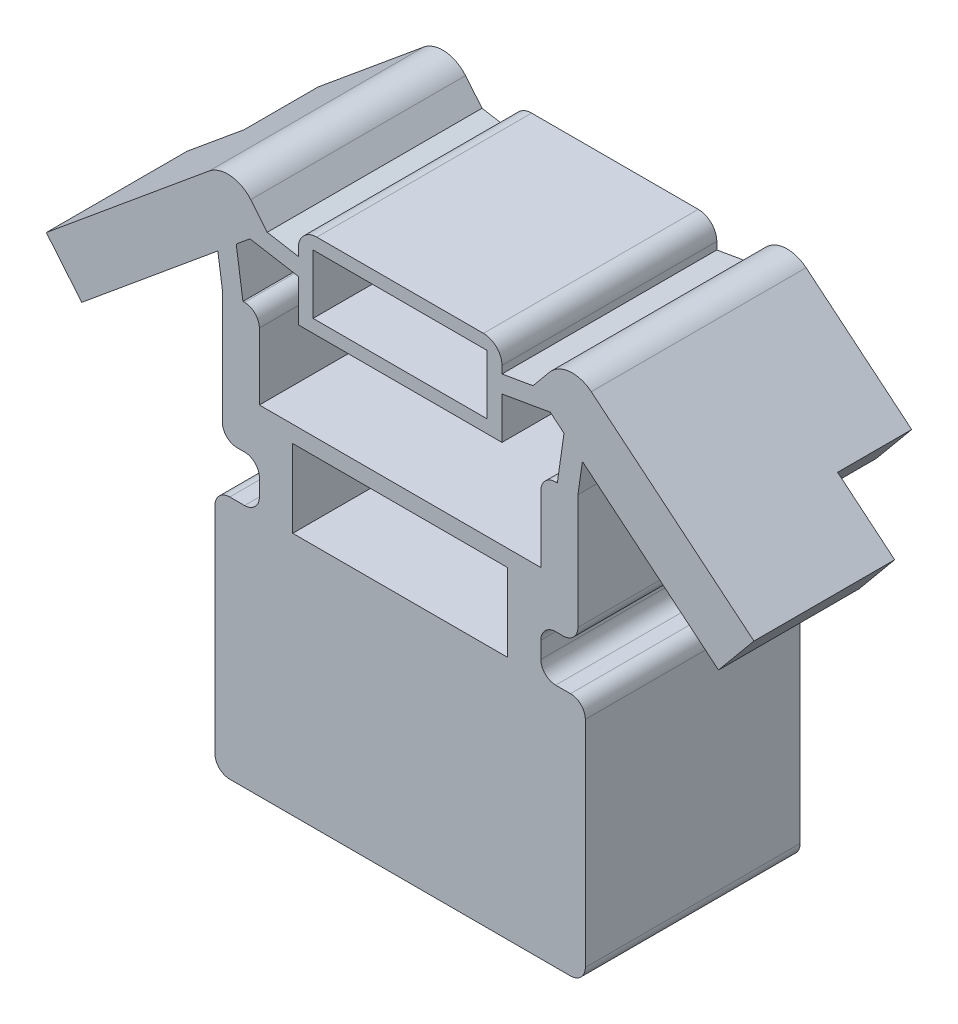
SolidWorks part; units mm, degrees
ref_plane "前视基准面" through (0, 0, 0) normal (0, 0, 1) x (1, 0, 0)
ref_plane "上视基准面" through (0, 0, 0) normal (0, 1, 0) x (1, 0, 0)
ref_plane "右视基准面" through (0, 0, 0) normal (1, 0, 0) x (0, 0, -1)
other "Configuration Table"
sketch "草图1" plane through (0, 0, 0) normal (0, 0, 1) x (1, 0, 0)
  line L0 (2.75, 5.4) -> (3.5876, 5.5447)
  line L1 (-3.8, -1.4) -> (3.8, -1.4)
  line L2 (-3.8, -1.4) -> (-3.8, 1.4)
  line L4 (3.8, -1.4) -> (3.8, 0.1)
  line L5 (-3.8, -1.4) -> (3.8, 1.4) construction
  line L6 (-3.8, 1.4) -> (3.8, -1.4) construction
  line L7 (-2.75, 5.4) -> (2.75, 5.4)
  line L8 (-2.75, 5.4) -> (-2.75, 3.8)
  line L9 (-2.75, 3.8) -> (2.75, 3.8)
  line L10 (2.75, 4.9332) -> (2.75, 3.8)
  line L11 (-2.75, 5.4) -> (2.75, 3.8) construction
  line L12 (-2.75, 3.8) -> (2.75, 5.4) construction
  line L14 (3.8, 0.1) -> (4.8, 0.1)
  line L17 (4.5438, 6.7004) -> (3.5876, 5.5447)
  line L19 (4.5438, 6.7004) -> (6.47, 5.1068)
  line L33 (2.75, 5.4) -> (2.75, 4.9332) construction
  line L34 (3.5876, 5.5447) -> (4.0544, 5.1585) construction
  line L37 (4.8, 3.6) -> (4.8, 0.1)
  line L38 (-3.8, 1.4) -> (3.8, 1.4)
  line L39 (3.8, 1.4) -> (3.8, 0.1) construction
  line L40 (0, 9.062) -> (0, -4.0269) construction
  line L41 (2.75, 4.9332) -> (4.0544, 5.1585)
  line L48 (4.0544, 5.1585) -> (4.4247, 4.8521)
  line L51 (4.2443, 3.6) -> (4.4247, 4.8521)
  line L53 (4.9212, 4.4413) -> (5.5138, 3.951)
  line L55 (4.4247, 4.8521) -> (4.9212, 4.4413) construction
  line L56 (4.2443, 3.6) -> (4.8, 3.6) construction
  line L57 (3.8, 1.4) -> (3.8, 3.6)
  line L58 (3.8, 3.6) -> (4.2443, 3.6)
  line L59 (4.8, 3.6) -> (4.9212, 4.4413)
  line L60 (5.5138, 3.951) -> (6.47, 5.1068)
  point P0 (0, 0)
  point P6 (0, 4.6)
  dimension "D1" = 7.6
  dimension "D2" = 2.8
  dimension "D3" = 5.5
  dimension "D4" = 1.6
  dimension "D5" = 1
  dimension "D6" = 81.8
  dimension "D7" = 0.85
  dimension "D8" = 0.46
  dimension "D9" = 3.5
  dimension "D10" = 1.5
  dimension "D11" = 0.55
  dimension "D12" = 2.2
  dimension "D13" = 0.85
  dimension "D14" = 2.4
  dimension "D15" = 2.5
  dimension "D16" = 99.8
extrude "凸台-拉伸1" add sketch "草图1" along normal blind 5.8
mirror "镜向1" about plane through (0, 0, 0) normal (1, 0, 0) of "凸台-拉伸1"
sketch "草图10" plane through (0, 0, 5.8) normal (0, 0, 1) x (1, 0, 0)
  line L0 (-2.75, 3.8) -> (2.75, 3.8) construction
  line L1 (-2.9, -1.05) -> (2.9, -1.05)
  line L2 (-2.9, -1.05) -> (-2.9, 1.05)
  line L3 (-2.9, 1.05) -> (2.9, 1.05)
  line L4 (2.9, -1.05) -> (2.9, 1.05)
  line L5 (-2.9, -1.05) -> (2.9, 1.05) construction
  line L6 (-2.9, 1.05) -> (2.9, -1.05) construction
  line L7 (-2.35, 5.75) -> (2.35, 5.75)
  line L8 (-2.35, 5.75) -> (-2.35, 4.15)
  line L9 (-2.35, 4.15) -> (2.35, 4.15)
  line L10 (2.35, 5.75) -> (2.35, 4.15)
  point P0 (0, 0)
  point P10 (0, 5.75)
  dimension "D1" = 5.8
  dimension "D2" = 2.1
  dimension "D3" = 4.7
  dimension "D4" = 1.6
  dimension "D5" = 0.35
extrude "切除-拉伸3" cut sketch "草图10" against normal through all
sketch "草图11" plane through (0, 0, 5.8) normal (0, 0, 1) x (1, 0, 0)
  line L0 (-2.35, 5.4) -> (-2.75, 5.4)
  line L1 (-2.75, 5.4) -> (-2.75, 6.1)
  line L2 (-2.75, 6.1) -> (2.75, 6.1)
  line L3 (2.75, 6.1) -> (2.75, 5.4)
  line L4 (2.75, 3.8) -> (2.75, 4.9332) construction
  line L5 (2.75, 5.4) -> (2.35, 5.4)
  line L6 (2.35, 5.4) -> (2.35, 5.75)
  line L7 (2.35, 5.75) -> (-2.35, 5.75)
  line L8 (-2.35, 5.75) -> (-2.35, 5.4)
  line L9 (-2.35, 4.15) -> (2.35, 4.15) construction
  dimension "D1" = 0.35
  dimension "D2" = 1.6
extrude "凸台-拉伸2" add sketch "草图11" against normal up to surface (5.8 mm away)
fillet "圆角1" radius 0.5 2 edges at (-2.75, 6.1, 2.9) (2.75, 6.1, 2.9)
sketch "草图12" plane through (0, 0, 5.8) normal (0, 0, 1) x (1, 0, 0)
  line L0 (-2.9, 1.05) -> (-2.9, -1.05) construction
  line L1 (-2.9, 0.95) -> (2.9, 0.95)
  line L2 (-2.9, 0.95) -> (-2.9, 1.05)
  line L3 (-2.9, 1.05) -> (2.9, 1.05)
  line L4 (2.9, 0.95) -> (2.9, 1.05)
  line L5 (3.8, -1.4) -> (3.8, 0.1) construction
  line L6 (-3.8, -1.4) -> (3.8, -1.4)
  line L7 (-3.8, -1.4) -> (-3.8, -1.5)
  line L8 (-3.8, -1.5) -> (3.8, -1.5)
  line L9 (3.8, -1.4) -> (3.8, -1.5)
  dimension "D1" = 0.1
  dimension "D2" = 0.1
extrude "凸台-拉伸3" add sketch "草图12" against normal up to surface (5.8 mm away)
sketch "草图14" plane through (0, 0, 5.8) normal (0, 0, 1) x (1, 0, 0)
  line L0 (2.9, -1.05) -> (2.9, 0.95) construction
  line L1 (-2.9, -1.05) -> (2.9, -1.05)
  line L2 (-2.9, -1.05) -> (-2.9, -1.15)
  line L3 (-2.9, -1.15) -> (2.9, -1.15)
  line L4 (2.9, -1.05) -> (2.9, -1.15)
  dimension "D1" = 0.1
extrude "切除-拉伸4" cut sketch "草图14" against normal through all
sketch "草图15" plane through (0, 0, 5.8) normal (0, 0, 1) x (1, 0, 0)
  line L0 (0, 5.4) -> (0, 1.4)
  line L2 (3.8, 1.4) -> (-3.8, 1.4) construction
  line L3 (0, 1.4) -> (3.8, 1.4)
  line L4 (3.8, 1.4) -> (3.8, 3.6)
  line L5 (3.8, 3.6) -> (4.8, 3.6)
  line L6 (4.8, 3.6) -> (4.9212, 4.4413)
  line L7 (4.9212, 4.4413) -> (3.5876, 5.5447)
  line L8 (3.5876, 5.5447) -> (2.75, 5.4)
  line L9 (2.75, 5.4) -> (0, 5.4)
sketch "草图16" plane through (0, 0, 5.8) normal (0, 0, 1) x (1, 0, 0)
  line L0 (-2.35, 5.75) -> (-2.35, 4.15) construction
  line L1 (-2.35, 4.25) -> (2.35, 4.25)
  line L2 (-2.35, 4.25) -> (-2.35, 4.15)
  line L3 (-2.35, 4.15) -> (2.35, 4.15)
  line L4 (2.35, 4.25) -> (2.35, 4.15)
  dimension "D1" = 0.1
extrude "凸台-拉伸4" [suppressed] add sketch "草图16" against normal up to surface (5.8 mm away)
fillet "圆角2" radius 0.4 2 edges at (-3.8, 3.6, 2.9) (3.8, 3.6, 2.9)
sketch "草图18" plane through (0, 0, 5.8) normal (0, 0, 1) x (1, 0, 0)
  line L1 (-5, -1.15) -> (-5, -7.75)
  line L2 (-5, -7.75) -> (5, -7.75)
  line L3 (5, -7.75) -> (5, -1.15)
  line L5 (3.8, -1.5) -> (-3.8, -1.5)
  line L6 (-2.9, 0.95) -> (2.9, 0.95) construction
  line L8 (-2.9, -1.15) -> (2.9, -1.15) construction
  line L9 (-4.4, -3.15) -> (4.4, -3.15)
  line L10 (-4.4, -3.15) -> (-4.4, -7.15)
  line L11 (-4.4, -7.15) -> (4.4, -7.15)
  line L12 (4.4, -3.15) -> (4.4, -7.15)
  line L13 (-5, -1.15) -> (-3.8, -1.15)
  line L14 (-3.8, 0.1) -> (-3.8, -1.5) construction
  line L15 (-3.8, -1.15) -> (-3.8, -1.5)
  line L16 (5, -1.15) -> (3.8, -1.15)
  line L17 (3.8, -1.5) -> (3.8, 0.1) construction
  line L18 (3.8, -1.15) -> (3.8, -1.5)
  point P11 (0, 0.95)
  point P12 (-4.4, -5.15)
  point P14 (0, -7.75)
  point P21 (0, -7.15)
  dimension "D1" = 4
  dimension "D2" = 2
  dimension "D3" = 8.8
  dimension "D4" = 0.6
  dimension "D5" = 0.6
extrude "凸台-拉伸6" add sketch "草图18" against normal up to surface (5.8 mm away)
sketch "草图19" plane through (0, 0, 5.8) normal (0, 0, 1) x (1, 0, 0)
  line L1 (-4.4, -3.15) -> (4.4, -3.15)
  line L2 (-4.4, -3.15) -> (-4.4, -7.15)
  line L3 (-4.4, -7.15) -> (4.4, -7.15)
  line L4 (4.4, -3.15) -> (4.4, -7.15)
extrude "凸台-拉伸7" add sketch "草图19" against normal blind 0.4
fillet "圆角3" radius 0.8 2 edges at (-4.5438, 6.7004, 2.9) (4.5438, 6.7004, 2.9)
fillet "圆角5" radius 0.4 10 edges at (-5, -7.75, 2.9) (5, -7.75, 2.9) (-5, -1.15, 2.9) (-3.8, -1.15, 2.9) (5, -1.15, 2.9) (3.8, -1.15, 2.9) (3.8, 0.1, 2.9) (4.8, 0.1, 2.9) (-3.8, 0.1, 2.9) (-4.8, 0.1, 2.9)
fillet "圆角6" radius 0.1 4 edges at (-4.4, -7.15, 2.7) (4.4, -7.15, 2.7) (-4.4, -3.15, 2.7) (4.4, -3.15, 2.7)
sketch "草图20" plane through (0, 0, 0) normal (0, 0, -1) x (-1, 0, 0)
  line L0 (-5.5138, 3.951) -> (-8.5958, 1.4012)
  line L1 (-8.5958, 1.4012) -> (-9.552, 2.557)
  line L2 (-9.552, 2.557) -> (-6.47, 5.1068)
  line L3 (-4.9212, 4.4413) -> (-5.5138, 3.951) construction
  line L4 (-6.47, 5.1068) -> (-5.5138, 3.951)
  line L5 (0, 0) -> (0, 8.4985) construction
  dimension "D1" = 180
  dimension "D2" = 4
extrude "凸台-拉伸8" add sketch "草图20" against normal up to surface (5.8 mm away)
mirror "镜向2" about plane through (0, 0, 0) normal (1, 0, 0) of "凸台-拉伸8"
sketch "草图23" plane through (0, 0, 0) normal (0, 0, -1) x (-1, 0, 0)
  line L0 (-4.3, -3.15) -> (4.3, -3.15) construction
  line L1 (-2.5, -1.75) -> (2.5, -1.75)
  line L2 (-2.5, -1.75) -> (-2.5, -3.15)
  line L3 (-2.5, -3.15) -> (2.5, -3.15)
  line L4 (2.5, -1.75) -> (2.5, -3.15)
  line L5 (2.9, -1.15) -> (-2.9, -1.15) construction
  line L6 (-2.9, 0.95) -> (2.9, 0.95) construction
  point P8 (0, -1.75)
  point P13 (0, 0.95)
  dimension "D1" = 0.6
  dimension "D2" = 5
extrude "切除-拉伸5" cut sketch "草图23" against normal up to surface (5.4 mm away)
fillet "圆角8" radius 0.4 4 edges at (2.5, -1.75, 2.7) (-2.5, -1.75, 2.7) (-2.5, -3.15, 2.7) (2.5, -3.15, 2.7)
sketch "草图24" plane through (0, 0, 0) normal (0, 0, -1) x (-1, 0, 0)
  line L0 (8.5958, 1.4012) -> (9.552, 2.557)
  line L1 (9.552, 2.557) -> (8.011, 3.8319)
  line L2 (9.552, 2.557) -> (5.1602, 6.1904) construction
  line L3 (8.011, 3.8319) -> (7.0548, 2.6761)
  line L4 (4.9212, 4.4413) -> (8.5958, 1.4012) construction
  line L5 (7.0548, 2.6761) -> (8.5958, 1.4012)
  dimension "D1" = 2
extrude "切除-拉伸6" cut sketch "草图24" against normal blind 2
mirror "镜向3" about plane through (0, 0, 0) normal (1, 0, 0) of "切除-拉伸6"
